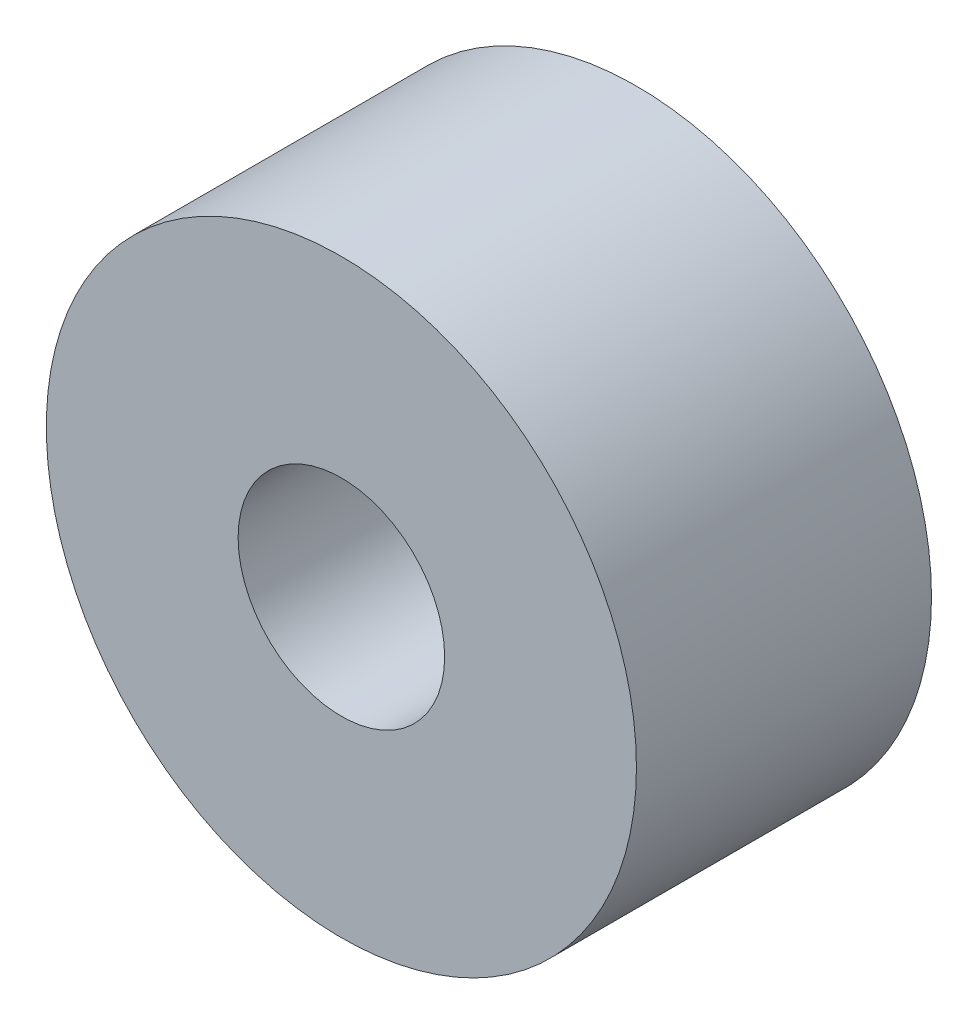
SolidWorks part; units mm, degrees
ref_plane "Front" through (0, 0, 0) normal (0, 0, 1) x (1, 0, 0)
ref_plane "Top" through (0, 0, 0) normal (0, 1, 0) x (1, 0, 0)
ref_plane "Right" through (0, 0, 0) normal (1, 0, 0) x (0, 0, -1)
sketch "Esquisse1" plane through (0, 0, 0) normal (0, 0, 1) x (1, 0, 0)
  circle A0 centre (0, 0) radius 20
  circle A1 centre (0, 0) radius 7
  dimension "D1" = 40
  dimension "D2" = 14
extrude "Base-Extrusion" add sketch "Esquisse1" along normal blind 20
